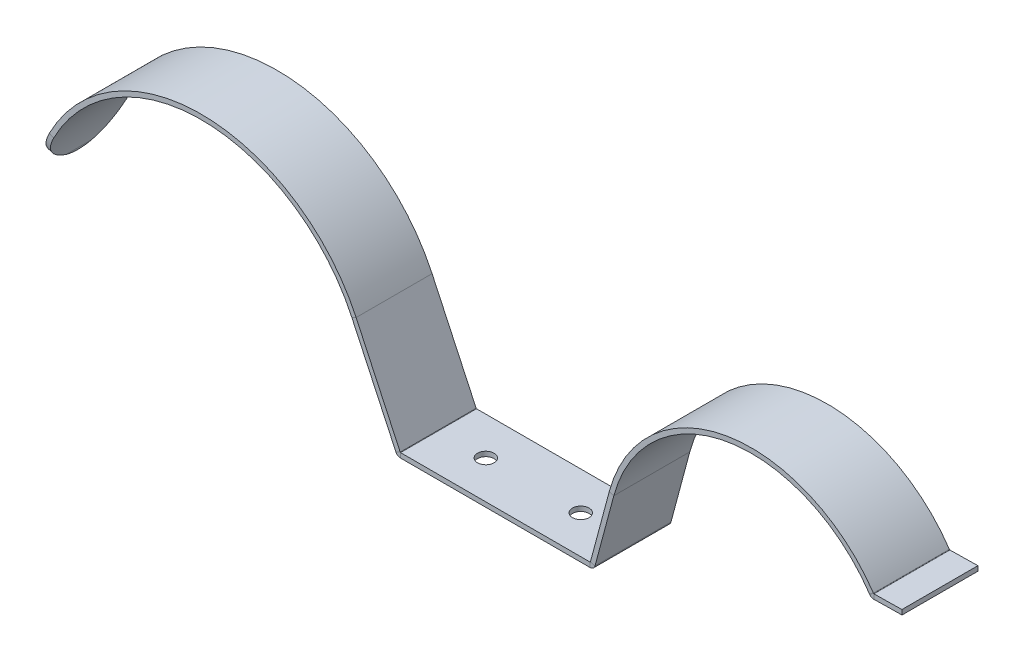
SolidWorks part; units mm, degrees
ref_plane "Front Plane" through (0, 0, 0) normal (0, 0, 1) x (1, 0, 0)
ref_plane "Top Plane" through (0, 0, 0) normal (0, 1, 0) x (1, 0, 0)
ref_plane "Right Plane" through (0, 0, 0) normal (1, 0, 0) x (0, 0, -1)
sketch "Sketch1" plane through (0, 0, 0) normal (0, 1, 0) x (1, 0, 0)
  line L0 (230, 8) -> (0, 8) construction
  line L1 (0, 0) -> (230, 0)
  line L2 (0, 0) -> (0, 16) construction
  line L3 (0, 16) -> (230, 16)
  line L4 (230, 0) -> (230, 16)
  arc A0 (0, 16) -> (0, 0) centre (0, 8) ccw
  circle A1 centre (110, 8) radius 1.75
  circle A2 centre (130, 8) radius 1.75
  dimension "D1" = 8
  dimension "D3" = 3.5
  dimension "D4" = 110
  dimension "D5" = 20
  dimension "D2" = 230
sheet metal parameters "Sheet-Metal1" thickness 1 parameters "D1"=1
base flange "Base-Flange1" sketch "Sketch1" thickness 1 reverse thickness direction yes parameters "D1"=1
sketch "Sketch3" plane through (0, 1, 0) normal (0, 1, 0) x (1, 0, 0)
  line L0 (100, 0) -> (100, 16)
  line L1 (0, 0) -> (230, 0) construction
  line L2 (230, 16) -> (0, 16) construction
  circle A0 centre (110, 8) radius 1.75 construction
  dimension "D1" = 10
sketched bend "Sketched Bend1" parameters "D1"=0.1
bend "SketchBend1" bend radius 0.1 bend angle 65 parameters "D5"=1
sketch "Sketch4" plane through (0, 1, 0) normal (0, 1, 0) x (1, 0, 0)
  line L0 (140, 0) -> (140, 16)
  line L1 (100.0567, 0) -> (230, 0) construction
  line L2 (230, 16) -> (100.0567, 16) construction
  circle A0 centre (130, 8) radius 1.75 construction
  dimension "D1" = 10
sketched bend "Sketched Bend2" parameters "D1"=0.1
bend "SketchBend2" bend radius 0.1 bend angle 75 parameters "D5"=2
sketch "Sketch5" plane through (0, 0, 0) normal (0, 0, 1) x (1, 0, 0)
  line L0 (139.9345, 0) -> (204.3202, 0) construction
  line L1 (140.9971, 0.8153) -> (164.2738, 87.6854) construction
  line L2 (173.9345, 7.8286) -> (144.9568, 15.5931)
  circle A0 centre (173.9345, 7.8286) radius 30
  dimension "D1" = 60
  dimension "D2" = 34
  dimension "D3" = 7.8286
sketch "Sketch7" plane through (131.3482, -35.1947, 0) normal (0.9659, -0.2588, 0) x (0, 0, -1)
  line L0 (0, 52.5794) -> (16, 52.5794)
  line L1 (16, 127.2148) -> (16, 37.2802) construction
sketched bend "Sketched Bend6" parameters "D1"=30
bend "SketchBend6" bend radius 30 bend angle 131 parameters "D5"=3
sketch "Sketch8" plane through (148.8752, 100.4176, 0) normal (0.829, 0.5592, 0) x (0.5592, -0.829, 0)
  line L0 (90.8167, 0) -> (90.8167, 16)
  line L1 (90.7728, 0) -> (96.8167, 0) construction
  line L2 (96.8167, 16) -> (90.7728, 16) construction
  line L3 (96.8167, 0) -> (96.8167, 16) construction
  dimension "D1" = 6
sketched bend "Sketched Bend8" parameters "D1"=0.1
bend "SketchBend7" bend radius 0.1 bend angle 57 parameters "D5"=4
sketch "Sketch9" plane through (0, 0, 0) normal (0, 0, 1) x (1, 0, 0)
  line L0 (100.0567, 0) -> (38.7211, 0) construction
  line L1 (56.8219, 91.2145) -> (99.0598, 0.6351) construction
  line L2 (58.0567, 5.7494) -> (89.7775, 20.5411)
  circle A0 centre (58.0567, 5.7494) radius 35
  dimension "D1" = 70
  dimension "D2" = 42
  dimension "D3" = 5.7494
sketch "Sketch11" plane through (81.6104, 38.0555, 0) normal (-0.9063, -0.4226, 0) x (0, 0, 1)
  line L0 (0, -19.3251) -> (-16, -19.3251)
  line L1 (-16, -41.2889) -> (-16, 58.6544) construction
sketched bend "Sketched Bend24" parameters "D1"=35
bend "SketchBend23" bend radius 35 bend angle 140 parameters "D5"=5
flat pattern "Flat-Pattern1"
sketch "Bend-Lines1" plane through (0, 0, 0) normal (0, 1, 0) x (-1, 0, 0)
bend of the flat pattern "Flatten-<SketchBend1>1"
bend of the flat pattern "Flatten-<SketchBend2>1"
bend of the flat pattern "Flatten-<SketchBend6>1"
bend of the flat pattern "Flatten-<SketchBend7>1"
bend of the flat pattern "Flatten-<SketchBend23>1"
